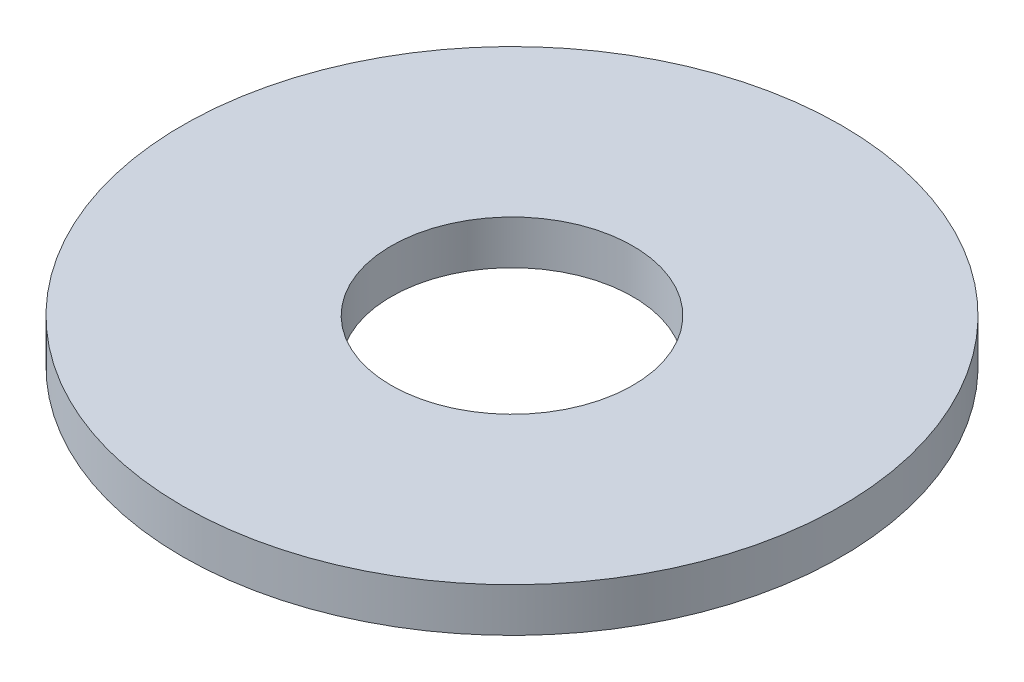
SolidWorks part; units mm, degrees
ref_plane "Face" through (0, 0, 0) normal (0, 0, 1) x (1, 0, 0)
ref_plane "Dessus" through (0, 0, 0) normal (0, 1, 0) x (1, 0, 0)
ref_plane "Droite" through (0, 0, 0) normal (1, 0, 0) x (0, 0, -1)
sketch "Esquisse1" plane through (0, 0, 0) normal (0, 1, 0) x (1, 0, 0)
  circle A0 centre (0, 0) radius 15
  circle A1 centre (0, 0) radius 5.5
  dimension "D1" = 30
  dimension "D2" = 11
extrude "Base-Extrusion" add sketch "Esquisse1" along normal blind 2
